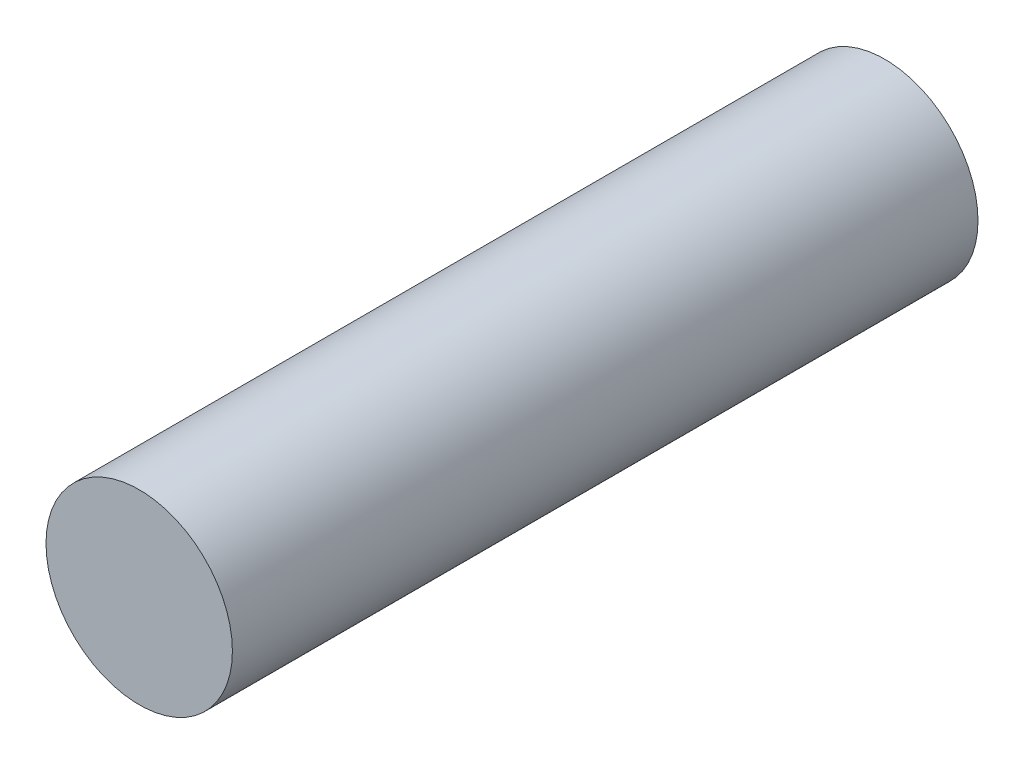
SolidWorks part; units mm, degrees
ref_plane "Front Plane" through (0, 0, 0) normal (0, 0, 1) x (1, 0, 0)
ref_plane "Top Plane" through (0, 0, 0) normal (0, 1, 0) x (1, 0, 0)
ref_plane "Right Plane" through (0, 0, 0) normal (1, 0, 0) x (0, 0, -1)
sketch "Sketch1" plane through (0, 0, 0) normal (0, 0, 1) x (1, 0, 0)
  circle A0 centre (0, 0) radius 3.175
extrude "Boss-Extrude1" add sketch "Sketch1" along normal mid plane 25.4
equation "\"D_shaft\"= 0.25in"
equation "\"L_shaft\"= 1in"
equation "\"D1@Sketch1@Part3.Part\"= \"D_shaft\""
equation "\"D1@Boss-Extrude1\"= \"L_shaft\""
